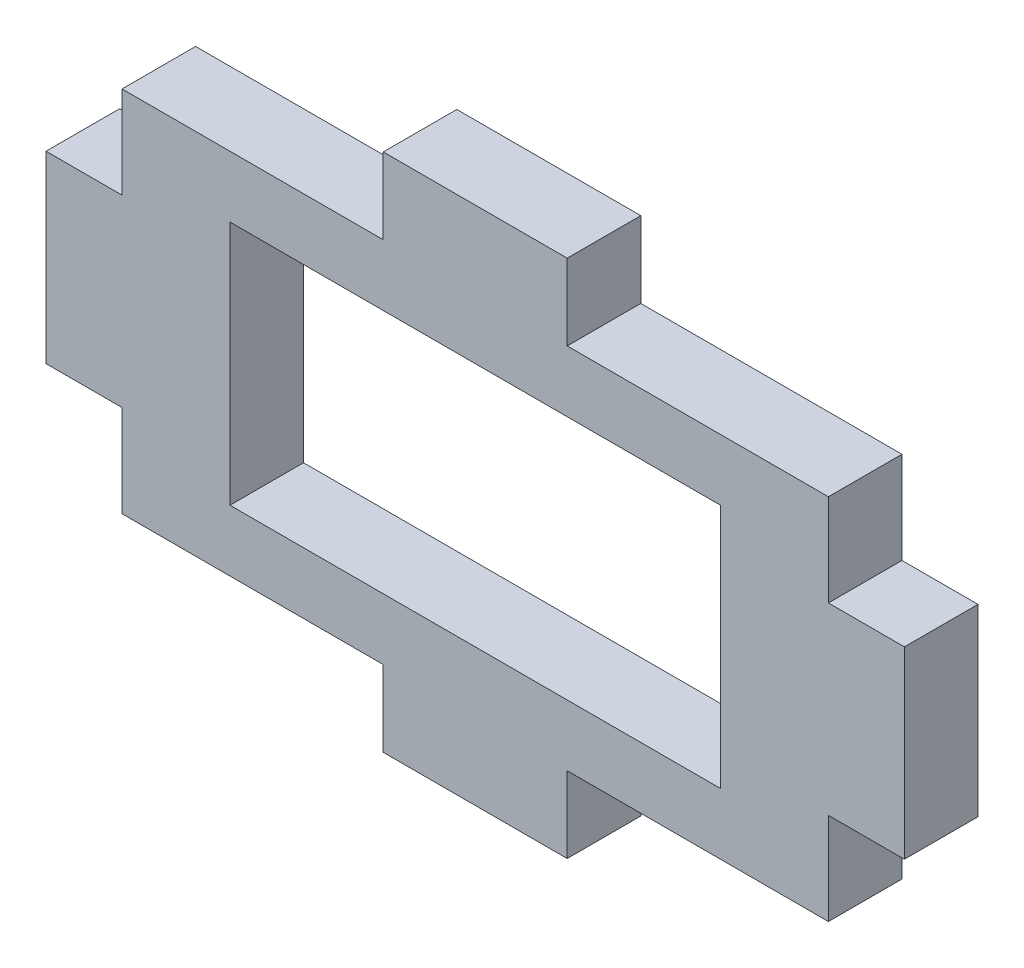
SolidWorks part; units mm, degrees
ref_plane "Front Plane" through (0, 0, 0) normal (0, 0, 1) x (1, 0, 0)
ref_plane "Top Plane" through (0, 0, 0) normal (0, 1, 0) x (1, 0, 0)
ref_plane "Right Plane" through (0, 0, 0) normal (1, 0, 0) x (0, 0, -1)
sketch "Sketch1" plane through (0, 0, 0) normal (0, 0, 1) x (1, 0, 0)
  line L0 (-28.8, 15) -> (28.8, -15) construction
  line L1 (-28.8, 15) -> (28.8, 15)
  line L2 (-28.8, 15) -> (-28.8, -15)
  line L3 (-28.8, -15) -> (28.8, -15)
  line L4 (28.8, 15) -> (28.8, -15)
  point P4 (0, 0)
  dimension "D1" = 30
  dimension "D2" = 57.6
extrude "Boss-Extrude1" add sketch "Sketch1" along normal blind 6
sketch "Sketch2" plane through (0, 0, 6) normal (0, 0, 1) x (1, 0, 0)
  line L0 (28.8, 15) -> (-28.8, 15) construction
  line L1 (-28.8, 15) -> (-28.8, -15) construction
  line L2 (-28.8, -15) -> (28.8, -15) construction
  line L3 (28.8, -15) -> (28.8, 15) construction
  line L4 (0, 15) -> (0, -15.4706) construction
  line B0 (-7.5, 15) -> (7.5, 15)
  line B1 (7.5, 15) -> (7.5, 21.2)
  line B2 (7.5, 21.2) -> (-7.5, 21.2)
  line B3 (-7.5, 21.2) -> (-7.5, 15)
  line B4 (-7.5, -21.2) -> (7.5, -21.2)
  line B5 (7.5, -21.2) -> (7.5, -15)
  line B6 (7.5, -15) -> (-7.5, -15)
  line B7 (-7.5, -15) -> (-7.5, -21.2)
  line B8 (-28.8, -7.5) -> (-28.8, 7.5)
  line B9 (-28.8, 7.5) -> (-35, 7.5)
  line B10 (-35, 7.5) -> (-35, -7.5)
  line B11 (-35, -7.5) -> (-28.8, -7.5)
  line B12 (35, -7.5) -> (35, 7.5)
  line B13 (35, 7.5) -> (28.8, 7.5)
  line B14 (28.8, 7.5) -> (28.8, -7.5)
  line B15 (28.8, -7.5) -> (35, -7.5)
sketch_block_instance "Block-laser-cut-slot-15x6-1"
sketch_block "Block-laser-cut-slot-15x6" parameters "D1"=15, "D2"=6.2
sketch_block_instance "Block-laser-cut-slot-15x6-2"
sketch_block_instance "Block-laser-cut-slot-15x6-3"
sketch_block_instance "Block-laser-cut-slot-15x6-4"
extrude "Boss-Extrude2" add sketch "Sketch2" against normal blind 6
sketch "Sketch3" plane through (0, 0, 6) normal (0, 0, 1) x (1, 0, 0)
  line L0 (0, 21.2) -> (0, -21.2) construction
  line L1 (-20, 10) -> (20, 10)
  line L2 (-20, 10) -> (-20, -10)
  line L3 (-20, -10) -> (20, -10)
  line L4 (20, 10) -> (20, -10)
  line L5 (7.5, 21.2) -> (-7.5, 21.2) construction
  line L6 (-7.5, -21.2) -> (7.5, -21.2) construction
  point P11 (-20, 0)
  dimension "D1" = 40
  dimension "D2" = 20
extrude "Cut-Extrude1" cut sketch "Sketch3" against normal blind 10
